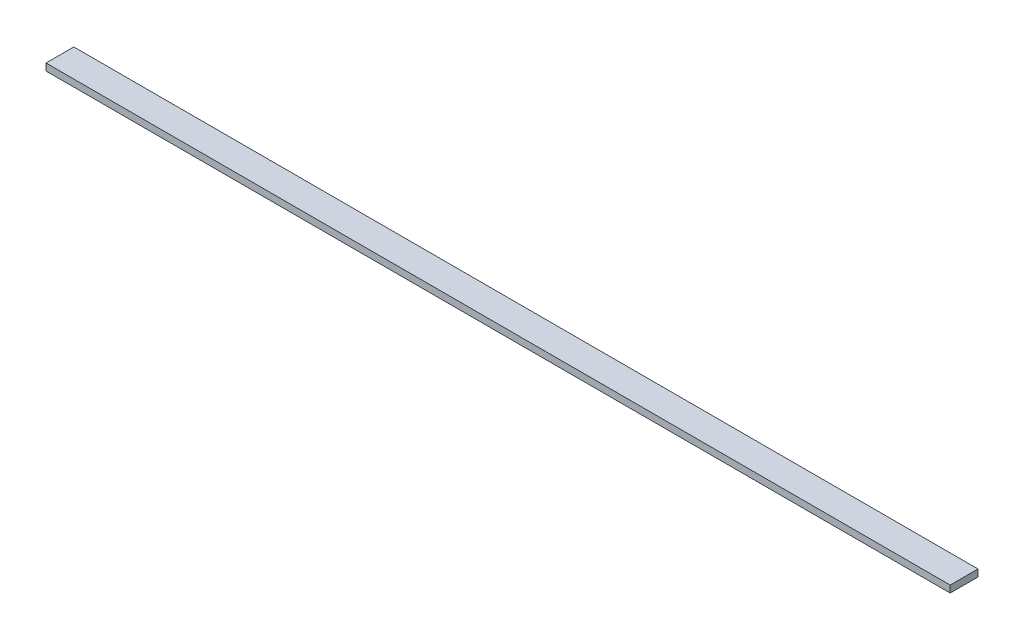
SolidWorks part; units mm, degrees
ref_plane "Front Plane" through (0, 0, 0) normal (0, 0, 1) x (1, 0, 0)
ref_plane "Top Plane" through (0, 0, 0) normal (0, 1, 0) x (1, 0, 0)
ref_plane "Right Plane" through (0, 0, 0) normal (1, 0, 0) x (0, 0, -1)
sketch "Sketch1" plane through (0, 0, 0) normal (0, 1, 0) x (1, 0, 0)
  line L1 (-412.75, -12.7) -> (412.75, -12.7)
  line L2 (-412.75, -12.7) -> (-412.75, 12.7)
  line L3 (-412.75, 12.7) -> (412.75, 12.7)
  line L4 (412.75, -12.7) -> (412.75, 12.7)
  line L5 (-412.75, -12.7) -> (412.75, 12.7) construction
  line L6 (-412.75, 12.7) -> (412.75, -12.7) construction
  point P0 (0, 0)
extrude "Boss-Extrude1" add sketch "Sketch1" along normal blind 6.35
equation "\"horizontal-component-length\"= \"railing-width\" - \"railing padding\""
equation "\"horizontal-component-width\"= 1in"
equation "\"D1@Sketch1\"=\"horizontal-component-length\""
equation "\"D2@Sketch1\"=\"horizontal-component-width\""
equation "\"material-thickness\"= .25in"
equation "\"D1@Boss-Extrude1\"=\"material-thickness\""
equation "\"railing-width\"= 33in"
equation "\"railing padding\"= .5in"
